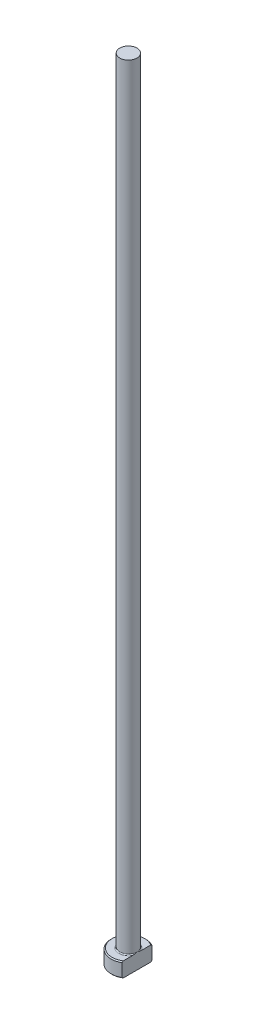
SolidWorks part; units mm, degrees
ref_plane "Front Plane" through (0, 0, 0) normal (0, 0, 1) x (1, 0, 0)
ref_plane "Top Plane" through (0, 0, 0) normal (0, 1, 0) x (1, 0, 0)
ref_plane "Right Plane" through (0, 0, 0) normal (1, 0, 0) x (0, 0, -1)
sketch "Sketch1" plane through (0, 0, 0) normal (0, 0, 1) x (1, 0, 0)
  line L0 (0, 259.9588) -> (0, -15.1925) construction
  line L1 (0, 0) -> (-3.5, 0)
  line L2 (-3.5, 0) -> (-3.5, 3)
  line L3 (-3.5, 3) -> (-1.75, 3)
  line L4 (-1.75, 3) -> (-1.75, 160)
  line L5 (-1.75, 160) -> (0, 160)
  line L6 (0, 160) -> (0, 0)
  dimension "L" = 160
  dimension "H" = 7
  dimension "T" = 3
  dimension "D" = 3.5
revolve "Revolve1" add sketch "Sketch1" angle 360 about L0
chamfer "Chamfer1" distance 0.2 angle 45 2 edges at (0, 3, 3.5) (0, 0, 3.5)
fillet "Fillet1" radius 0.2 1 edges at (0, 3, 1.75)
sketch "Sketch2" plane through (0, 0, 0) normal (0, 1, 0) x (1, 0, 0)
  line L0 (1.75, 3.0311) -> (1.75, -3.0311)
  circle A0 centre (0, 0) radius 3.5 construction
  arc A1 (1.75, -3.0311) -> (1.75, 3.0311) centre (0, 0) ccw
  circle A2 centre (0, 0) radius 1.75 construction
extrude "KEY" cut sketch "Sketch2" along normal through all
